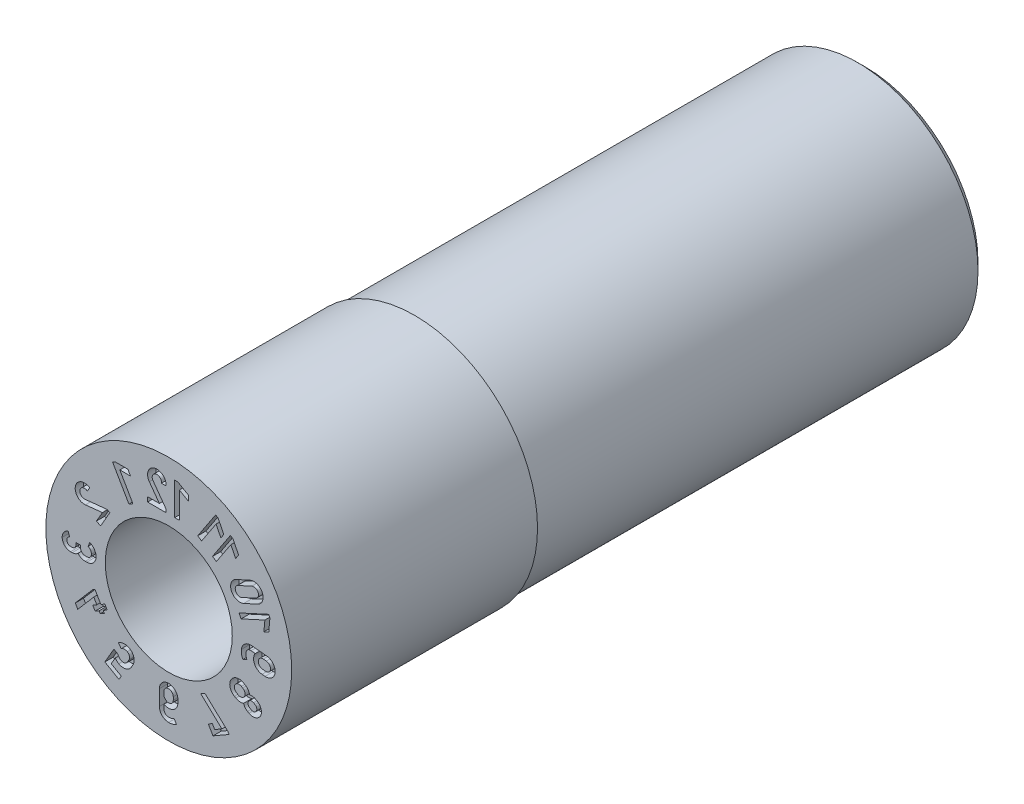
SolidWorks part; units mm, degrees
ref_plane "Front Plane" through (0, 0, 0) normal (0, 0, 1) x (1, 0, 0)
ref_plane "Top Plane" through (0, 0, 0) normal (0, 1, 0) x (1, 0, 0)
ref_plane "Right Plane" through (0, 0, 0) normal (1, 0, 0) x (0, 0, -1)
sketch "Sketch1" plane through (0, 0, 0) normal (1, 0, 0) x (0, 0, -1)
  line L2 (0, 3) -> (0, 1.55)
  line L3 (16.75, 3) -> (0, 3)
  line L4 (-3.7979, 0) -> (49996.2021, 0) construction
  line L8 (14, 0.8) -> (2.8, 0.8)
  line L9 (2.8, 1.55) -> (2.8, 0.8)
  line L10 (2.8, 1.55) -> (0, 1.55)
  line L12 (17, 1.5) -> (17, 2.75)
  line L16 (17, 2.75) -> (16.75, 3)
  line L17 (17, 1.5) -> (14, 1.5)
  line L18 (14, 0.8) -> (14, 1.5)
  dimension "D1" = 17
  dimension "D2" = 45
  dimension "D3" = 0.25
  dimension "D4" = 6
  dimension "D5" = 3.1
  dimension "D6" = 2.8
  dimension "D7" = 1.6
  dimension "D8" = 3
  dimension "D9" = 3
revolve "Revolve1" add sketch "Sketch1" angle 360 about L4
sketch "Sketch4" plane through (0, 0, 0) normal (1, 0, 0) x (0, 0, -1)
  line L0 (0, 0) -> (50000, 0) construction
  line L1 (17, -2.75) -> (17, 2.75) construction
  line L2 (6, 3.935) -> (17, 3.935)
  line L3 (6, 3.935) -> (6, 2.935)
  line L4 (6, 2.935) -> (17, 2.935)
  line L5 (17, 3.935) -> (17, 2.935)
  line L6 (16.75, 3) -> (0, 3) construction
  line L9 (0, 55) -> (0, -55) construction
  dimension "D1" = 1
  dimension "D2" = 0.065
  dimension "D3" = 6
revolve "Cut-Revolve1" cut sketch "Sketch4" angle 360 about L0
sketch "Sketch2" plane through (0, 0, 0) normal (0, 0, 1) x (1, 0, 0)
  line L230 (1.5045, 2.0997) -> (1.5668, 2.0585)
  line L231 (1.5668, 2.0585) -> (1.704, 1.7849)
  line L232 (1.704, 1.7849) -> (1.6319, 1.6759)
  line L233 (1.6319, 1.6759) -> (1.5147, 1.9096)
  line L234 (1.5147, 1.9096) -> (1.1617, 1.3755)
  line L235 (1.1617, 1.3755) -> (1.0672, 1.4379)
  line L236 (1.0672, 1.4379) -> (1.5045, 2.0997)
  line L237 (1.1437, 2.3542) -> (1.2059, 2.313)
  line L238 (1.2059, 2.313) -> (1.3432, 2.0395)
  line L239 (1.3432, 2.0395) -> (1.2711, 1.9304)
  line L240 (1.2711, 1.9304) -> (1.1539, 2.1641)
  line L241 (1.1539, 2.1641) -> (0.8009, 1.63)
  line L242 (0.8009, 1.63) -> (0.7064, 1.6925)
  line L243 (0.7064, 1.6925) -> (1.1437, 2.3542)
  line L244 (1.783, 0.9273) -> (2.1228, 1.0834)
  line L245 (2.0282, 1.2894) -> (1.6884, 1.1333)
  line L246 (2.381, -0.118) -> (2.3076, -0.1111)
  line L247 (2.2866, -0.3368) -> (2.3599, -0.3436)
  line L248 (2.3915, -0.0051) -> (2.0192, 0.0296)
  line L249 (1.8078, -0.3718) -> (1.9101, -0.3226)
  line L250 (2.3492, -0.4564) -> (2.276, -0.4498)
  line L251 (2.1122, -0.0929) -> (2.0086, -0.0833)
  line L252 (1.9784, -1.3122) -> (2.0128, -1.332)
  line L253 (2.1034, -1.175) -> (2.0691, -1.1552)
  line L254 (0.7808, -1.6066) -> (0.8832, -1.5474)
  line L255 (0.8832, -1.5474) -> (1.4446, -2.0764)
  line L256 (1.4446, -2.0764) -> (1.4718, -2.1235)
  line L257 (1.4718, -2.1235) -> (1.0793, -2.3502)
  line L258 (1.0793, -2.3502) -> (0.9659, -2.1539)
  line L259 (0.9659, -2.1539) -> (1.0641, -2.0972)
  line L260 (1.0641, -2.0972) -> (1.1207, -2.1953)
  line L261 (1.1207, -2.1953) -> (1.2974, -2.0934)
  line L262 (1.2974, -2.0934) -> (0.7808, -1.6066)
  line L263 (1.658, -1.1534) -> (1.6923, -1.1732)
  line L264 (1.8056, -0.9769) -> (1.7713, -0.9571)
  line L265 (1.8623, -0.8788) -> (1.828, -0.8589)
  line L266 (1.6013, -1.2515) -> (1.6357, -1.2713)
  line L267 (1.9218, -1.4104) -> (1.9561, -1.4302)
  line L268 (2.16, -1.077) -> (2.1257, -1.057)
  line L269 (2.4374, 0.8988) -> (2.4685, 0.831)
  line L270 (2.4685, 0.831) -> (2.4406, 0.5262)
  line L271 (2.4406, 0.5262) -> (2.3218, 0.4717)
  line L272 (2.3218, 0.4717) -> (2.3456, 0.732)
  line L273 (2.3456, 0.732) -> (1.7639, 0.4648)
  line L274 (1.7639, 0.4648) -> (1.7166, 0.5677)
  line L275 (1.7166, 0.5677) -> (2.4374, 0.8988)
  line L276 (1.9809, 1.3924) -> (1.6411, 1.2363)
  line L277 (1.8303, 0.8243) -> (2.1701, 0.9804)
  line L278 (0.1451, 2.5897) -> (0.2196, 2.5897)
  line L279 (0.2196, 2.5897) -> (0.485, 2.4371)
  line L280 (0.485, 2.4371) -> (0.485, 2.3064)
  line L281 (0.485, 2.3064) -> (0.2584, 2.4367)
  line L282 (0.2584, 2.4367) -> (0.2584, 1.7965)
  line L283 (0.2584, 1.7965) -> (0.1451, 1.7965)
  line L284 (0.1451, 1.7965) -> (0.1451, 2.5897)
  line L285 (-0.5174, 1.7947) -> (-0.0642, 1.7947)
  line L286 (-0.0642, 1.7947) -> (-0.0642, 1.8697)
  line L287 (-0.0642, 1.8697) -> (-0.3828, 2.3121)
  line L288 (-0.1788, 2.3613) -> (-0.0648, 2.3613)
  line L289 (-0.4749, 2.2457) -> (-0.2285, 1.9081)
  line L290 (-0.2285, 1.9081) -> (-0.5174, 1.9081)
  line L291 (-0.5174, 1.9081) -> (-0.5174, 1.7947)
  line L292 (-1.3697, 2.2106) -> (-1.3051, 2.2479)
  line L293 (-1.3051, 2.2479) -> (-0.9991, 2.2484)
  line L294 (-0.9991, 2.2484) -> (-0.9337, 2.1352)
  line L295 (-0.9337, 2.1352) -> (-1.1951, 2.1347)
  line L296 (-1.1951, 2.1347) -> (-0.875, 1.5803)
  line L297 (-0.875, 1.5803) -> (-0.9731, 1.5236)
  line L298 (-0.9731, 1.5236) -> (-1.3697, 2.2106)
  line L299 (-0.1169, -2.0067) -> (-0.1169, -2.0803)
  line L300 (0.1097, -2.0803) -> (0.1097, -2.0067)
  line L301 (0.223, -2.0068) -> (0.2233, -2.0803)
  line L302 (-0.1169, -2.2766) -> (-0.1169, -2.3806)
  line L303 (-0.2303, -2.0067) -> (-0.2302, -2.3806)
  line L304 (0.1891, -2.5538) -> (0.1306, -2.4565)
  line L305 (-1.3075, -1.8973) -> (-1.4043, -2.0649)
  line L306 (-1.4043, -2.0649) -> (-1.159, -2.2066)
  line L307 (-1.159, -2.2066) -> (-1.2156, -2.3047)
  line L308 (-1.2156, -2.3047) -> (-1.5591, -2.1064)
  line L309 (-1.5591, -2.1064) -> (-1.3392, -1.7255)
  line L310 (-1.3392, -1.7255) -> (-1.241, -1.7821)
  line L311 (-1.0098, -1.8348) -> (-0.9729, -1.771)
  line L312 (-1.1606, -1.6271) -> (-1.2312, -1.5383)
  line L313 (-0.8748, -1.8277) -> (-0.9117, -1.8914)
  line L314 (-2.0005, -0.105) -> (-2.0402, -0.105)
  line L315 (-2.1535, 0.0083) -> (-2.1535, 0.0649)
  line L316 (-2.1535, 0.0649) -> (-2.2668, 0.0649)
  line L317 (-2.2668, 0.0649) -> (-2.2668, 0.0083)
  line L318 (-2.3574, -0.0824) -> (-2.3971, -0.0824)
  line L319 (-2.4184, 0.1049) -> (-2.4547, 0.2122)
  line L320 (-2.3971, -0.1957) -> (-2.3574, -0.1957)
  line L321 (-2.0402, -0.2184) -> (-2.0005, -0.2184)
  line L322 (-1.9281, 0.2349) -> (-1.9697, 0.1295)
  line L323 (-2.281, -1.2206) -> (-2.221, -1.3245)
  line L324 (-2.221, -1.3245) -> (-1.8295, -0.8695)
  line L325 (-1.8295, -0.8695) -> (-1.7561, -0.9967)
  line L326 (-1.7561, -0.9967) -> (-1.8542, -1.0533)
  line L327 (-1.8542, -1.0533) -> (-1.7975, -1.1514)
  line L328 (-1.7975, -1.1514) -> (-1.6994, -1.0948)
  line L329 (-1.6994, -1.0948) -> (-1.6711, -1.1439)
  line L330 (-1.6711, -1.1439) -> (-1.573, -1.0872)
  line L331 (-1.573, -1.0872) -> (-1.6013, -1.0381)
  line L332 (-1.6013, -1.0381) -> (-1.5032, -0.9815)
  line L333 (-1.5032, -0.9815) -> (-1.5598, -0.8834)
  line L334 (-1.5598, -0.8834) -> (-1.658, -0.94)
  line L335 (-1.658, -0.94) -> (-1.7996, -0.6947)
  line L336 (-1.7996, -0.6947) -> (-1.857, -0.7278)
  line L337 (-1.857, -0.7278) -> (-2.281, -1.2206)
  line L338 (-1.7633, 0.7709) -> (-1.6651, 0.7143)
  line L339 (-1.6651, 0.7143) -> (-1.4385, 1.1068)
  line L340 (-1.4385, 1.1068) -> (-1.5034, 1.1443)
  line L341 (-1.5034, 1.1443) -> (-2.0458, 1.0895)
  line L342 (-1.9864, 1.2908) -> (-1.9295, 1.3895)
  line L343 (-2.0344, 0.9766) -> (-1.6188, 1.0212)
  line L344 (-1.6188, 1.0212) -> (-1.7633, 0.7709)
  arc A108 (1.6884, 1.1333) -> (1.783, 0.9273) centre (1.7357, 1.0303) ccw
  arc A109 (2.1228, 1.0834) -> (2.0282, 1.2894) centre (2.0755, 1.1864) ccw
  arc A110 (2.3076, -0.1111) -> (2.2866, -0.3368) centre (2.2971, -0.224) ccw
  arc A111 (2.3599, -0.3436) -> (2.381, -0.118) centre (2.3704, -0.2308) ccw
  arc A112 (2.0192, 0.0296) -> (1.7725, -0.175) centre (1.9981, -0.1961) ccw
  arc A113 (1.7725, -0.175) -> (1.8078, -0.3718) centre (2.1445, -0.2098) ccw
  arc A114 (2.3492, -0.4564) -> (2.3915, -0.0051) centre (2.3704, -0.2308) ccw
  arc A115 (2.1122, -0.0929) -> (2.276, -0.4498) centre (2.2963, -0.2245) ccw
  arc A116 (2.0086, -0.0833) -> (1.8864, -0.1769) centre (1.9981, -0.196) ccw
  arc A117 (1.8864, -0.1769) -> (1.9101, -0.3226) centre (2.1106, -0.2153) ccw
  arc A118 (2.0691, -1.1552) -> (1.9784, -1.3122) centre (2.0236, -1.2336) ccw
  arc A119 (2.0128, -1.332) -> (2.1034, -1.175) centre (2.0581, -1.2535) ccw
  arc A120 (1.7713, -0.9571) -> (1.658, -1.1534) centre (1.7147, -1.0552) ccw
  arc A121 (1.6923, -1.1732) -> (1.8056, -0.9769) centre (1.749, -1.0751) ccw
  arc A122 (1.9723, -1.0363) -> (1.8623, -0.8788) centre (1.749, -1.0751) ccw
  arc A123 (1.828, -0.8589) -> (1.6013, -1.2515) centre (1.7145, -1.0551) ccw
  arc A124 (1.6357, -1.2713) -> (1.8271, -1.2878) centre (1.749, -1.0751) ccw
  arc A125 (1.8271, -1.2878) -> (1.9218, -1.4104) centre (2.024, -1.2336) ccw
  arc A126 (1.9561, -1.4302) -> (2.16, -1.077) centre (2.0581, -1.2536) ccw
  arc A127 (2.1257, -1.057) -> (1.9723, -1.0363) centre (2.024, -1.232) ccw
  arc A128 (1.6411, 1.2363) -> (1.8303, 0.8243) centre (1.7357, 1.0303) ccw
  arc A129 (2.1701, 0.9804) -> (1.9809, 1.3924) centre (2.0755, 1.1864) ccw
  arc A130 (-0.1788, 2.3613) -> (-0.3828, 2.3121) centre (-0.2908, 2.3783) ccw
  arc A131 (-0.0648, 2.3613) -> (-0.4749, 2.2457) centre (-0.2909, 2.3782) ccw
  arc A132 (-0.1169, -2.0803) -> (0.1097, -2.0803) centre (-0.0036, -2.0803) ccw
  arc A133 (0.1097, -2.0067) -> (-0.1169, -2.0067) centre (-0.0036, -2.0067) ccw
  arc A134 (0.223, -2.0068) -> (-0.2303, -2.0067) centre (-0.0036, -2.0067) ccw
  arc A135 (-0.1169, -2.2766) -> (0.2233, -2.0803) centre (-0.003, -2.0811) ccw
  arc A136 (-0.1169, -2.3806) -> (-0.0123, -2.4936) centre (-0.0036, -2.3806) ccw
  arc A137 (-0.0123, -2.4936) -> (0.1306, -2.4565) centre (0.0051, -2.2668) ccw
  arc A138 (-0.2302, -2.3806) -> (-0.0036, -2.6072) centre (-0.0035, -2.3806) ccw
  arc A139 (-0.0036, -2.6072) -> (0.1891, -2.5538) centre (-0.0035, -2.2336) ccw
  arc A140 (-1.241, -1.7821) -> (-1.1645, -1.8763) centre (-1.0794, -1.729) ccw
  arc A141 (-1.1645, -1.8763) -> (-1.0098, -1.8348) centre (-1.1079, -1.7782) ccw
  arc A142 (-0.9729, -1.771) -> (-1.0144, -1.6162) centre (-1.071, -1.7143) ccw
  arc A143 (-1.0144, -1.6162) -> (-1.1606, -1.6271) centre (-1.0795, -1.7292) ccw
  arc A144 (-0.9578, -1.5181) -> (-1.2312, -1.5383) centre (-1.0796, -1.7289) ccw
  arc A145 (-0.8748, -1.8277) -> (-0.9578, -1.5181) centre (-1.0713, -1.7144) ccw
  arc A146 (-1.2212, -1.9744) -> (-0.9117, -1.8914) centre (-1.1081, -1.7776) ccw
  arc A147 (-1.3075, -1.8973) -> (-1.2212, -1.9744) centre (-1.0812, -1.7309) ccw
  arc A148 (-1.8872, 0.0083) -> (-1.9697, 0.1295) centre (-2.0175, 0.0083) ccw
  arc A149 (-2.0005, -0.105) -> (-1.8872, 0.0083) centre (-2.0005, 0.0083) ccw
  arc A150 (-2.1535, 0.0083) -> (-2.0402, -0.105) centre (-2.0402, 0.0083) ccw
  arc A151 (-2.3574, -0.0824) -> (-2.2668, 0.0083) centre (-2.3574, 0.0083) ccw
  arc A152 (-2.4877, 0.0083) -> (-2.3971, -0.0824) centre (-2.397, 0.0084) ccw
  arc A153 (-2.4184, 0.1049) -> (-2.4877, 0.0083) centre (-2.3859, 0.0084) ccw
  arc A154 (-2.4547, 0.2122) -> (-2.601, 0.0083) centre (-2.3857, 0.0082) ccw
  arc A155 (-2.601, 0.0083) -> (-2.3971, -0.1957) centre (-2.3971, 0.0082) ccw
  arc A156 (-2.3574, -0.1957) -> (-2.2142, -0.1369) centre (-2.3574, 0.0082) ccw
  arc A157 (-2.2142, -0.1369) -> (-2.0402, -0.2184) centre (-2.0402, 0.0082) ccw
  arc A158 (-2.0005, -0.2184) -> (-1.7739, 0.0083) centre (-2.0005, 0.0082) ccw
  arc A159 (-1.7739, 0.0083) -> (-1.9281, 0.2349) centre (-2.0176, 0.0082) ccw
  arc A160 (-1.9864, 1.2908) -> (-2.0458, 1.0895) centre (-2.0572, 1.2023) ccw
  arc A161 (-1.9295, 1.3895) -> (-2.0344, 0.9766) centre (-2.0571, 1.2022) ccw
  point P446 (0, 0.0044)
  point P447 (0.0044, 0.0044)
  point P448 (0.0044, 0)
extrude "Cut-Extrude1" cut sketch "Sketch2" against normal blind 0.2
sketch "Sketch3" plane through (0, 0, -2.8) normal (0, 0, 1) x (1, 0, 0)
  line L0 (0, 0) -> (0, 50000) construction
  line L1 (0.4619, 0.8) -> (-0.4619, 0.8)
  line L2 (-0.4619, 0.8) -> (-0.9238, 0)
  line L3 (-0.9238, 0) -> (-0.4619, -0.8)
  line L4 (-0.4619, -0.8) -> (0.4619, -0.8)
  line L5 (0.4619, -0.8) -> (0.9238, 0)
  line L6 (0.9238, 0) -> (0.4619, 0.8)
  line L7 (0, 0) -> (50000, 0) construction
  circle A0 centre (0, 0) radius 0.8 construction
  circle A1 centre (0, 0) radius 0.8 construction
extrude "Cut-Extrude2" cut sketch "Sketch3" against normal blind 1.4
